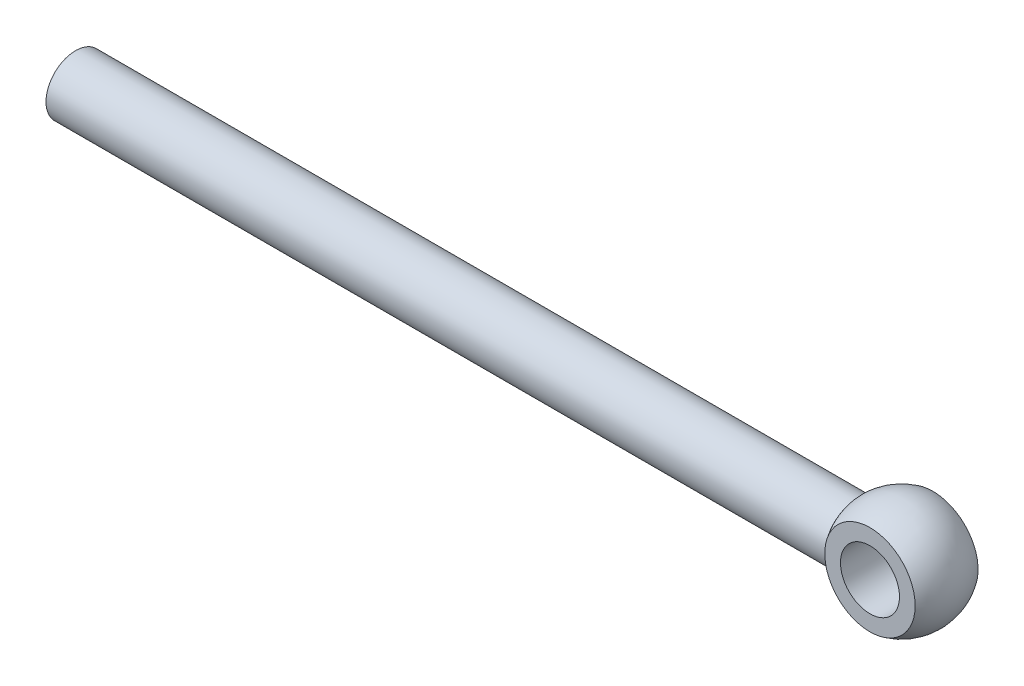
SolidWorks part; units mm, degrees
ref_plane "Front" through (0, 0, 0) normal (0, 0, 1) x (1, 0, 0)
ref_plane "Top" through (0, 0, 0) normal (0, 1, 0) x (1, 0, 0)
ref_plane "Right" through (0, 0, 0) normal (1, 0, 0) x (0, 0, -1)
sketch "Sketch1" plane through (0, 0, 0) normal (1, 0, 0) x (0, 0, -1)
  circle A0 centre (0, 0) radius 37.5
  dimension "D1" = 75
sketch "Sketch2" plane through (0, 0, 0) normal (0, 0, 1) x (1, 0, 0)
  line L0 (0, 0) -> (1050, 0) construction
  line L2 (980, 0) -> (1120, 0)
  arc A0 (980, 0) -> (1120, 0) centre (1050, 0) cw
  dimension "D2" = 70
  dimension "D1" = 1050
revolve "Revolve1" add sketch "Sketch2" angle 360 about L0
extrude "Extrude1" add sketch "Sketch1" along normal up to body separate body
sketch "Sketch3" plane through (0, 0, 0) normal (0, 1, 0) x (1, 0, 0)
  line L2 (1120, 40) -> (1120, -40)
  line L3 (980, -40) -> (1120, -40)
  line L4 (980, -40) -> (1120, -40)
  line L5 (980, 40) -> (1120, 40)
  line L6 (980, 40) -> (1120, 40)
  dimension "D1" = 40
  dimension "D2" = 40
extrude "Cut-Extrude1" cut sketch "Sketch3" against normal through all and the other way through all
sketch "Sketch5" plane through (0, 0, 40) normal (0, 0, 1) x (1, 0, 0)
  circle A0 centre (1050, 0) radius 37.5
  circle A4 centre (1050, 0) radius 57.4456 construction
  dimension "D1" = 75
extrude "Cut-Extrude3" cut sketch "Sketch5" against normal through all
